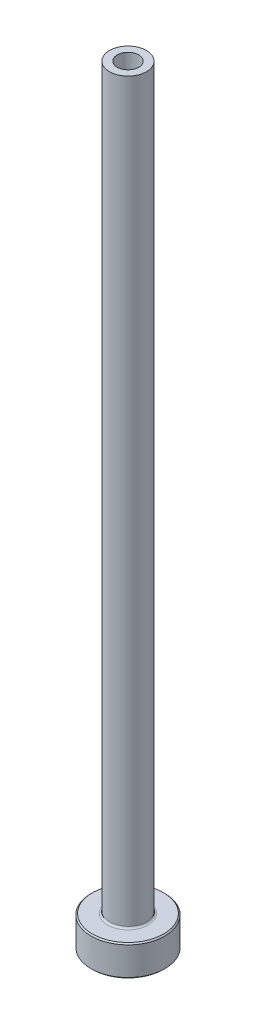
SolidWorks part; units mm, degrees
ref_plane "Front Plane" through (0, 0, 0) normal (0, 0, 1) x (1, 0, 0)
ref_plane "Top Plane" through (0, 0, 0) normal (0, 1, 0) x (1, 0, 0)
ref_plane "Right Plane" through (0, 0, 0) normal (1, 0, 0) x (0, 0, -1)
sketch "Sketch1" plane through (0, 0, 0) normal (0, 0, 1) x (1, 0, 0)
  line L0 (-1.75, 125) -> (-3, 125)
  line L1 (-3, 125) -> (-3, 5)
  line L2 (-3, 5) -> (-6, 5)
  line L3 (-6, 5) -> (-6, 0)
  line L4 (6.6, 0) -> (-6.6, 0) construction
  line L5 (-6, 0) -> (-2, 0)
  line L6 (-1.75, 80) -> (-1.75, 125)
  line L7 (0, 92.1877) -> (0, -15.5353) construction
  line L8 (0, -6.6) -> (0, 6.6) construction
  line L9 (-1.75, 80) -> (-2, 68)
  line L10 (-2, 68) -> (-2, 0)
  dimension "D1" = 0.25
  dimension "ID" = 3.5
  dimension "OD" = 6
  dimension "L" = 125
  dimension "H" = 12
  dimension "T" = 5
  dimension "N" = 45
  dimension "D2" = 12
revolve "Revolve1" add sketch "Sketch1" angle 360 about L7
fillet "Fillet1" radius 0.3 1 edges at (0, 5, 3)
chamfer "Chamfer1" distance 0.2 angle 45 2 edges at (0, 5, 6) (0, 0, 6)
chamfer "Chamfer3" distance 0.5 angle 45 1 edges at (0, 0, 2)
